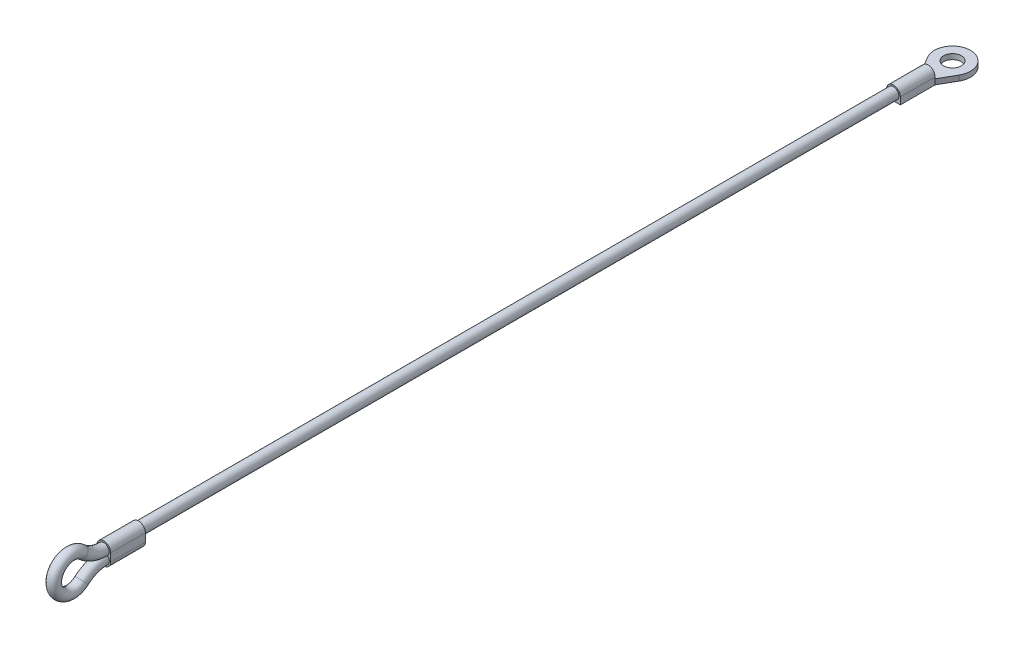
SolidWorks part; units mm, degrees
ref_plane "Front Plane" through (0, 0, 0) normal (0, 0, 1) x (1, 0, 0)
ref_plane "Top Plane" through (0, 0, 0) normal (0, 1, 0) x (1, 0, 0)
ref_plane "Right Plane" through (0, 0, 0) normal (1, 0, 0) x (0, 0, -1)
sketch "Sketch1" plane through (0, 0, 0) normal (1, 0, 0) x (0, 0, -1)
  line L2 (-227.4, 0) -> (0, 0)
  arc A0 (-227.4, 0) -> (-233.8, 2.4446) centre (-227.4, 9.6) cw
  arc A1 (-233.8, 2.4446) -> (-233.8, -4.7108) centre (-237, -1.1331) ccw
  arc A2 (-233.8, -4.7108) -> (-227.4, -2.2663) centre (-227.4, -11.8663) cw
  dimension "D1" = 4.8
  dimension "D4" = 9.6
  dimension "D2" = 237
  dimension "D3" = 9.6
sketch "Sketch2" plane through (0, 0, 0) normal (0, 0, 1) x (1, 0, 0)
  circle A0 centre (0, 0) radius 1.59
  dimension "D1" = 3.18
sweep "Sweep1" add profiles "Sketch2" path "Sketch1"
sketch "Sketch3" plane through (0, 0, 227.4) normal (0, 0, -1) x (-1, 0, 0)
  line L0 (0, 0) -> (0, -2.2663) construction
  line L1 (1.99, 0) -> (1.99, -2.2663)
  line L2 (-1.99, 0) -> (-1.99, -2.2663)
  line L3 (-1.59, -2.2663) -> (1.59, -2.2663) construction
  arc A0 (1.99, 0) -> (-1.99, 0) centre (0, 0) ccw
  arc A1 (-1.99, -2.2663) -> (1.99, -2.2663) centre (0, -2.2663) ccw
  point P3 (0, -1.1331)
  dimension "D1" = 3.98
extrude "Boss-Extrude1" add sketch "Sketch3" along normal blind 10
sketch "Sketch4" plane through (0, 0, 0) normal (0, 0, -1) x (-1, 0, 0)
  line L0 (-1.99, 0) -> (-1.99, -1.99)
  line L1 (-1.99, -1.99) -> (0, -1.99)
  line L2 (0, -1.99) -> (1.99, -1.99)
  line L3 (1.99, -1.99) -> (1.99, 0)
  arc A0 (1.99, 0) -> (-1.99, 0) centre (0, 0) ccw
  dimension "D1" = 3.98
extrude "Boss-Extrude2" add sketch "Sketch4" along normal blind 10
sketch "Sketch5" plane through (0, -1.99, 0) normal (0, -1, 0) x (1, 0, 0)
  line L0 (-1.99, -10) -> (1.99, -10)
  line L1 (1.99, -10) -> (4.5171, -14.4138)
  line L2 (-4.5171, -14.4138) -> (-1.99, -10)
  arc A0 (4.5171, -14.4138) -> (-4.5171, -14.4138) centre (0, -17) cw
  circle A1 centre (0, -17) radius 2.54
  point P8 (-5.205, -17)
  point P9 (5.205, -17)
  dimension "D1" = 5.08
  dimension "D2" = 10.41
  dimension "D3" = 17
extrude "Boss-Extrude3" add sketch "Sketch5" against normal blind 1.52
